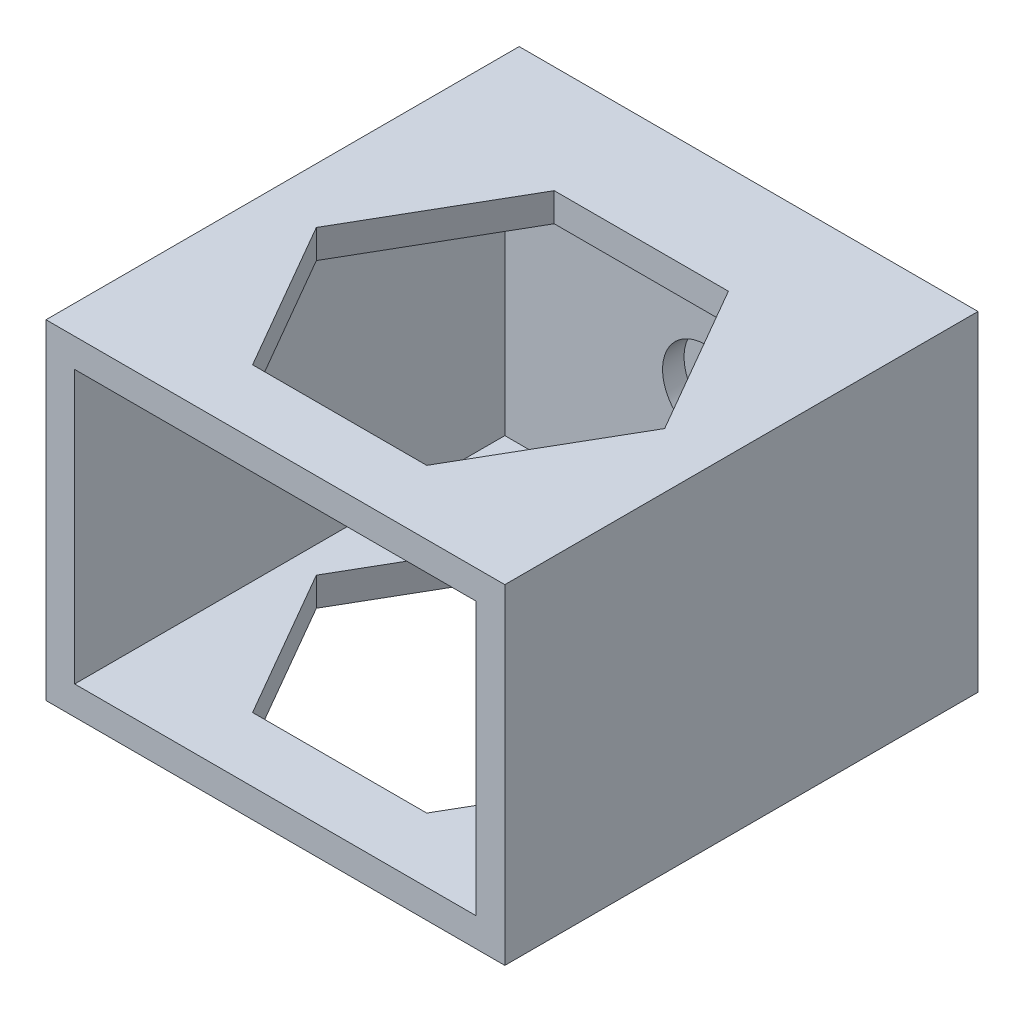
SolidWorks part; units mm, degrees
ref_plane "Plano frontal" through (0, 0, 0) normal (0, 0, 1) x (1, 0, 0)
ref_plane "Plano superior" through (0, 0, 0) normal (0, 1, 0) x (1, 0, 0)
ref_plane "Plano direito" through (0, 0, 0) normal (1, 0, 0) x (0, 0, -1)
sketch "Esboço1" plane through (0, 0, 0) normal (0, 0, 1) x (1, 0, 0)
  line L0 (-23.9182, 18.3986) -> (8.0818, 18.3986)
  line L7 (8.0818, 18.3986) -> (8.0818, -4.6014)
  line L8 (-23.9182, -4.6014) -> (8.0818, -4.6014)
  line L9 (-23.9182, 18.3986) -> (-23.9182, -4.6014)
  circle A0 centre (-7.9182, 6.8986) radius 1.5
  point P0 (-7.9182, 6.8986)
  dimension "D4" = 3
extrude "Ressalto-extrusão1" add sketch "Esboço1" along normal blind 3
sketch "Esboço2" plane through (0, 0, 3) normal (0, 0, 1) x (1, 0, 0)
  line L1 (-23.9182, 18.3986) -> (8.0818, 18.3986)
  line L2 (-23.9182, 18.3986) -> (-23.9182, -4.6014)
  line L3 (-23.9182, -4.6014) -> (8.0818, -4.6014)
  line L4 (8.0818, 18.3986) -> (8.0818, -4.6014)
  circle A0 centre (-7.9182, 6.8986) radius 1.5
  circle A1 centre (-7.9182, 6.8986) radius 3
  dimension "D1" = 6
extrude "Corte-extrusão1" cut sketch "Esboço2" against normal blind 1.5 contours A0 | A1
sketch "Esboço3" plane through (0, 0, 3) normal (0, 0, 1) x (1, 0, 0)
  line L0 (-21.9182, 16.3986) -> (-21.9182, -2.6014)
  line L1 (-23.9182, 18.3986) -> (8.0818, 18.3986)
  line L2 (-23.9182, 18.3986) -> (-23.9182, -4.6014)
  line L3 (-23.9182, -4.6014) -> (8.0818, -4.6014)
  line L4 (8.0818, 18.3986) -> (8.0818, -4.6014)
  line L5 (-21.9182, -2.6014) -> (6.0818, -2.6014)
  line L6 (6.0818, 16.3986) -> (6.0818, -2.6014)
  line L7 (-21.9182, 16.3986) -> (6.0818, 16.3986)
  dimension "D1" = 2
extrude "Ressalto-extrusão2" add sketch "Esboço3" along normal blind 30
sketch "Esboço4" plane through (0, -4.6014, 0) normal (0, -1, 0) x (1, 0, 0)
  line L0 (-23.9182, 33) -> (-23.9182, 0) construction
  line L2 (-21.9182, 3) -> (6.0818, 3)
  line L3 (-21.9182, 3) -> (-21.9182, 33)
  line L4 (-21.9182, 33) -> (6.0818, 33)
  line L5 (6.0818, 3) -> (6.0818, 33)
  line L6 (-20.0646, 18) -> (-13.9914, 7.4809)
  line L7 (-13.9914, 7.4809) -> (-1.8449, 7.4809)
  line L8 (-1.8449, 7.4809) -> (4.2283, 18)
  line L9 (4.2283, 18) -> (-1.8449, 28.5191)
  line L10 (-1.8449, 28.5191) -> (-13.9914, 28.5191)
  line L11 (-13.9914, 28.5191) -> (-20.0646, 18)
  circle A0 centre (-7.9182, 18) radius 10.5191 construction
  point P0 (-21.9182, 33)
  point P1 (-23.9182, 3)
  point P3 (-21.9182, 3)
  point P13 (-7.9182, 18)
  dimension "D1" = 3
extrude "Corte-extrusão2" cut sketch "Esboço4" against normal blind 30 contours L6 L7 L8 L9 L10 L11
